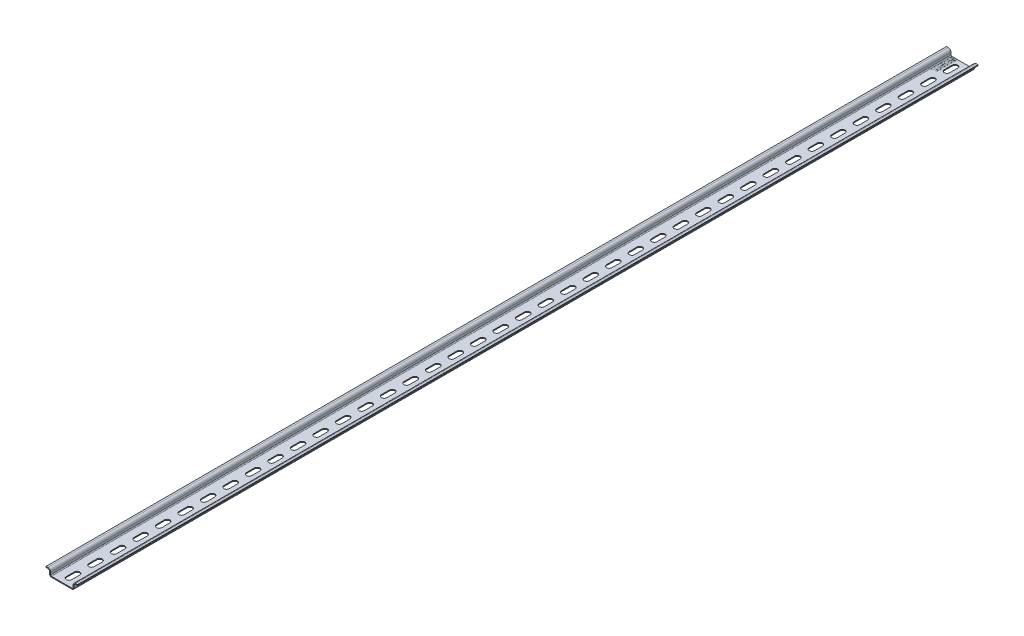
SolidWorks part; units mm, degrees
ref_plane "Front Plane" through (0, 0, 0) normal (0, 0, 1) x (1, 0, 0)
ref_plane "Top Plane" through (0, 0, 0) normal (0, 1, 0) x (1, 0, 0)
ref_plane "Right Plane" through (0, 0, 0) normal (1, 0, 0) x (0, 0, -1)
sketch "Sketch1" plane through (0, 0, 0) normal (0, 0, 1) x (1, 0, 0)
  line L0 (-11.5, 0) -> (11.5, 0)
  line L1 (13.5, 2) -> (13.5, 4.5)
  line L2 (15.5, 6.5) -> (17.5, 6.5)
  line L3 (0, 0) -> (0, 6.5) construction
  line L4 (-15.5, 6.5) -> (-17.5, 6.5)
  line L5 (-13.5, 2) -> (-13.5, 4.5)
  arc A0 (-15.5, 6.5) -> (-13.5, 4.5) centre (-15.5, 4.5) cw
  arc A1 (-13.5, 2) -> (-11.5, 0) centre (-11.5, 2) ccw
  arc A2 (11.5, 0) -> (13.5, 2) centre (11.5, 2) ccw
  arc A3 (13.5, 4.5) -> (15.5, 6.5) centre (15.5, 4.5) cw
  point P11 (-13.5, 6.5)
  point P14 (-13.5, 0)
  point P17 (13.5, 0)
  point P20 (13.5, 6.5)
  dimension "D4" = 2
  dimension "D1" = 6.5
  dimension "D2" = 13.5
  dimension "D3" = 17.5
extrude "Base Profile" add sketch "Sketch1" along normal blind 25 thin
sketch "Sketch2" plane through (0, 1, 0) normal (0, 1, 0) x (1, 0, 0)
  line L0 (0, -16.95) -> (0, -8.05) construction
  line L1 (-2.99, -16.95) -> (-2.99, -8.05)
  line L2 (2.99, -16.95) -> (2.99, -8.05)
  line L3 (-11.5, -12.5) -> (11.5, -12.5) construction
  line L4 (-11.5, -25) -> (-11.5, 0) construction
  line L5 (11.5, -25) -> (11.5, 0) construction
  arc A0 (-2.99, -16.95) -> (2.99, -16.95) centre (0, -16.95) ccw
  arc A1 (2.99, -8.05) -> (-2.99, -8.05) centre (0, -8.05) ccw
  point P3 (0, -12.5)
  dimension "D1" = 5.98
  dimension "D2" = 8.9
extrude "Slot" cut sketch "Sketch2" against normal up to next
sketch "Sketch3"
sketch_block_instance "Block-Techna Logo-1"
sketch_block "Block2"
sketch_block_instance "Block1-1"
sketch_block "Block1" parameters "D1"=0.25, "D2"=0.1, "D3"=0.05, "D4"=0.05, "D5"=0.05, "D6"=0.05, "D7"=0.05, "D8"=0.05, "D9"=0.3, "D10"=0.3, "D11"=0.3, "D12"=0.3, "D13"=0.3, "D14"=0.3, "D15"=0.9, "D16"=0.9, "D17"=1.8, "D18"=1.8, "D19"=0.9, "D20"=0.9, "D21"=1.8, "D22"=0.75, "D23"=0.9, "D24"=1.8, "D25"=1.8, "D26"=0.9, "D27"=0.9, "D28"=0.9, "D29"=0.9, "D30"=0.9, "D31"=0.6, "D32"=0.45, "D33"=0.45, "D34"=0.45, "D35"=0.45
extrude "Extrude1" cut sketch "Sketch3" against normal blind 0.1
pattern_linear "LPattern1" count 40 spacing 25 along (0, 0, 1) of "Base Profile", "Slot"
